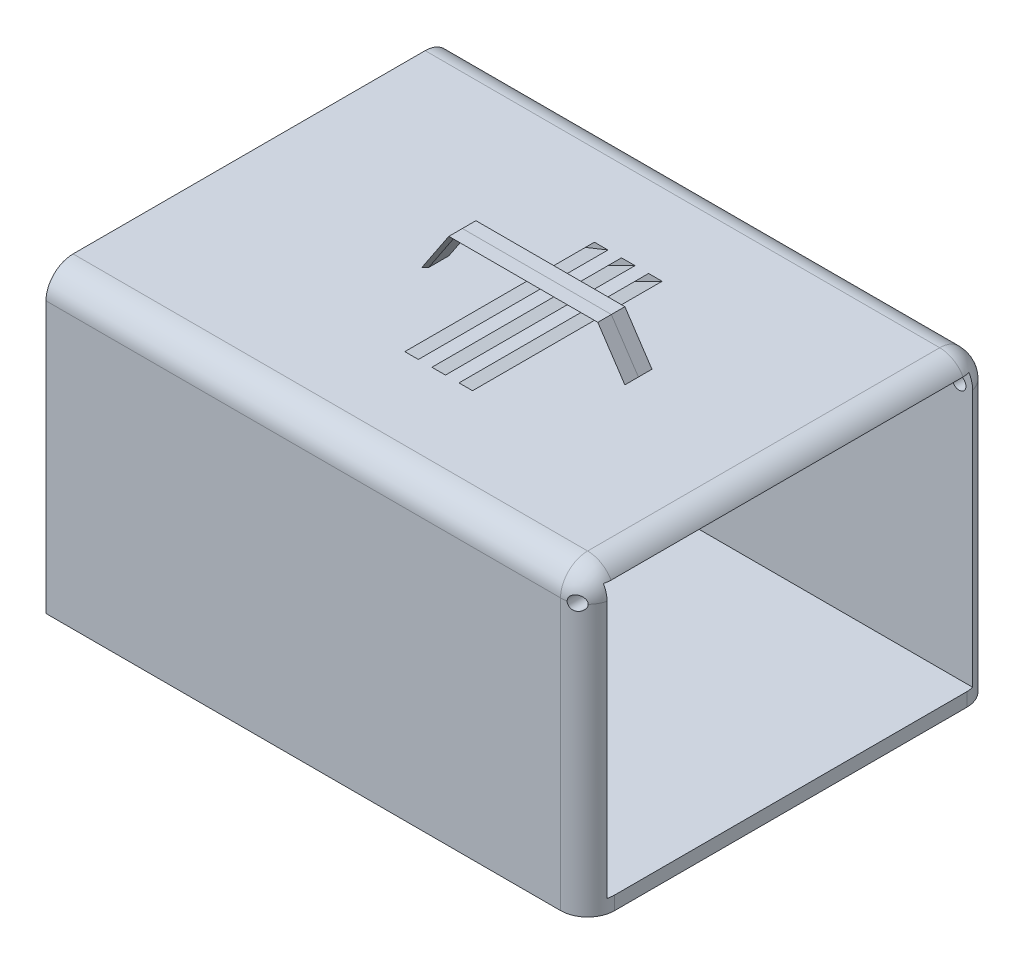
SolidWorks part; units mm, degrees
ref_plane "Front Plane" through (0, 0, 0) normal (0, 0, 1) x (1, 0, 0)
ref_plane "Top Plane" through (0, 0, 0) normal (0, 1, 0) x (1, 0, 0)
ref_plane "Right Plane" through (0, 0, 0) normal (1, 0, 0) x (0, 0, -1)
sketch "Sketch1" plane through (0, 0, 0) normal (0, 0, 1) x (1, 0, 0)
  line L0 (0, 0) -> (400, 0)
  line L1 (400, 0) -> (400, 220)
  line L2 (400, 220) -> (0, 220)
  line L3 (0, 220) -> (0, 0)
  dimension "D1" = 400
  dimension "D2" = 220
extrude "Boss-Extrude1" add sketch "Sketch1" along normal blind 300
sketch "Sketch2" plane through (400, 0, 0) normal (1, 0, 0) x (0, 0, -1)
  line L0 (-300, 0) -> (-285, 0) construction
  line L1 (-300, 0) -> (0, 0) construction
  line L2 (-285, 0) -> (-285, 10) construction
  line L3 (0, 0) -> (0, 220) construction
  line L4 (-285, 10) -> (-15, 10)
  line L5 (-285, 10) -> (-285, 210)
  line L6 (-285, 210) -> (-15, 210)
  line L7 (-15, 10) -> (-15, 210)
  line L8 (-300, 220) -> (0, 220) construction
  dimension "D1" = 15
  dimension "D2" = 10
  dimension "D3" = 15
  dimension "D4" = 10
extrude "Cut-Extrude1" cut sketch "Sketch2" against normal blind 390
fillet "Fillet1" radius 20 2 edges at (200, 220, 0) (200, 220, 300)
fillet "Fillet2" radius 20 2 edges at (400, 100, 0) (400, 100, 300)
sketch "Sketch3" plane through (0, 0, 0) normal (0, -1, 0) x (1, 0, 0)
  line L0 (0, 150) -> (33.64, 150) construction
  line L1 (0, 300) -> (0, 0) construction
  line L2 (33.64, 270) -> (33.64, 30)
  line L3 (33.64, 30) -> (83.64, 30)
  line L4 (83.64, 30) -> (83.64, 270)
  line L5 (83.64, 270) -> (33.64, 270)
  point P8 (33.64, 150)
  dimension "D1" = 33.64
  dimension "D2" = 240
  dimension "D3" = 50
extrude "Cut-Extrude2" cut sketch "Sketch3" against normal blind 20
sketch "Sketch4" plane through (0, 0, 0) normal (0, -1, 0) x (1, 0, 0)
  line L0 (360, 0) -> (360, 4) construction
  line L1 (0, 0) -> (380, 0) construction
  line L2 (400, 280) -> (400, 20) construction
  line L3 (360, 4) -> (120, 4)
  line L4 (120, 4) -> (120, 6)
  line L5 (120, 6) -> (360, 6)
  line L6 (360, 6) -> (360, 4)
  line L7 (400, 150) -> (83.64, 150) construction
  line L8 (83.64, 30) -> (83.64, 270) construction
  dimension "D1" = 40
  dimension "D2" = 4
  dimension "D3" = 2
  dimension "D4" = 240
ref_plane "Plane1" through (0, 0, 150) normal (0, 0, 1) x (-1, 0, 0)
extrude "Cut-Extrude3" cut sketch "Sketch4" against normal blind 100
mirror "Mirror1" about plane through (0, 0, 150) normal (0, 0, 1) of "Cut-Extrude3"
ref_plane "Ebene1" through (0, 0, 150) normal (0, 0, -1) x (-1, 0, 0)
ref_plane "Ebene2" through (200, 0, 0) normal (-1, 0, 0) x (0, 0, 1)
sketch "Skizze3" plane through (0, 0, 285) normal (0, 0, -1) x (-1, 0, 0)
  line L0 (-399.3649, 200) -> (-399.3649, 10) construction
  line L1 (-10, 210) -> (-396.5831, 210) construction
  circle A0 centre (-389.3649, 200) radius 5
  dimension "D3" = 10
  dimension "D1" = 10
  dimension "D2" = 10
extrude "Schnitt-Linear austragen1" cut sketch "Skizze3" against normal up to next
mirror "Spiegeln1" about plane through (0, 0, 150) normal (0, 0, -1) of "Schnitt-Linear austragen1"
sketch "Sketch6" plane through (0, 220, 0) normal (0, 1, 0) x (1, 0, 0)
  line L2 (185, -80) -> (185, -220)
  line L3 (185, -220) -> (195, -220)
  line L4 (195, -220) -> (195, -80)
  line L5 (195, -80) -> (185, -80)
  line L6 (195, -80) -> (205, -80) construction
  line L7 (215, -80) -> (225, -80) construction
  line L8 (205, -80) -> (215, -80)
  line L9 (205, -80) -> (205, -220)
  line L10 (205, -220) -> (215, -220)
  line L11 (215, -80) -> (215, -220)
  line L12 (185, -150) -> (0, -150) construction
  line L13 (225, -80) -> (235, -80)
  line L14 (225, -80) -> (225, -220)
  line L15 (225, -220) -> (235, -220)
  line L16 (235, -80) -> (235, -220)
  line L17 (0, -280) -> (0, -20) construction
  point P7 (185, -150)
  dimension "D1" = 185
  dimension "D2" = 10
  dimension "D3" = 10
  dimension "D4" = 10
  dimension "D5" = 10
  dimension "D6" = 10
  dimension "D7" = 140
  dimension "D8" = 140
  dimension "D9" = 140
sketch "Sketch7" plane through (0, 210, 0) normal (0, -1, 0) x (1, 0, 0)
  line L0 (160, 150) -> (0, 150) construction
  line L2 (160, 220) -> (160, 80)
  line L3 (160, 220) -> (170, 220)
  line L4 (170, 220) -> (170, 80)
  line L5 (170, 80) -> (160, 80)
  point P3 (0, 150)
  point P8 (160, 150)
  dimension "D1" = 140
  dimension "D2" = 10
  dimension "D3" = 160
loft "Cut-Loft2" cut
sketch "Sketch8" plane through (0, 220, 0) normal (0, 1, 0) x (1, 0, 0)
  line L0 (195, -80) -> (205, -80) construction
  line L2 (205, -80) -> (215, -80)
  line L3 (205, -80) -> (205, -220)
  line L4 (205, -220) -> (215, -220)
  line L5 (215, -80) -> (215, -220)
  dimension "D1" = 140
  dimension "D2" = 10
  dimension "D3" = 10
sketch "Sketch9" plane through (0, 210, 0) normal (0, -1, 0) x (1, 0, 0)
  line L0 (205, 220) -> (195, 220) construction
  line L2 (195, 220) -> (185, 220)
  line L3 (195, 220) -> (195, 80)
  line L4 (195, 80) -> (185, 80)
  line L5 (185, 220) -> (185, 80)
  dimension "D1" = 10
  dimension "D2" = 140
  dimension "D3" = 10
loft "Cut-Loft3" cut profiles "Sketch9", "Sketch8"
sketch "Sketch10" plane through (0, 220, 0) normal (0, 1, 0) x (1, 0, 0)
  line L0 (215, -80) -> (225, -80) construction
  line L2 (225, -80) -> (235, -80)
  line L3 (225, -80) -> (225, -220)
  line L4 (225, -220) -> (235, -220)
  line L5 (235, -80) -> (235, -220)
  dimension "D1" = 10
  dimension "D2" = 140
  dimension "D3" = 10
sketch "Sketch11" plane through (0, 210, 0) normal (0, -1, 0) x (1, 0, 0)
  line L0 (225, 220) -> (215, 220) construction
  line L2 (215, 220) -> (205, 220)
  line L3 (215, 220) -> (215, 80)
  line L4 (215, 80) -> (205, 80)
  line L5 (205, 220) -> (205, 80)
  dimension "D1" = 140
  dimension "D2" = 10
  dimension "D3" = 10
loft "Cut-Loft4" cut profiles "Sketch11", "Sketch10"
sketch "Sketch12" plane through (0, 220, 0) normal (0, 1, 0) x (1, 0, 0)
  line L0 (0, -150) -> (140, -150) construction
  line L1 (0, -280) -> (0, -20) construction
  line L2 (140, -142.5) -> (140, -157.5)
  line L3 (140, -157.5) -> (137.5, -160)
  line L5 (137.5, -140) -> (140, -142.5)
  line L6 (137.5, -155.6972) -> (140, -155.6972) construction
  line L7 (138.75, -155.6972) -> (138.75, -150) construction
  line L8 (137.5, -140) -> (137.5, -150)
  line L9 (137.5, -150) -> (137.5, -160)
  point P7 (140, -150)
  dimension "D1" = 15
  dimension "D2" = 20
  dimension "D3" = 45
  dimension "D4" = 45
  dimension "D5" = 140
  dimension "D6" = 4.3028
ref_plane "Plane2" through (0, 0, 150) normal (0, 0, 1) x (1, 0, 0)
sketch "Sketch13" plane through (0, 0, 150) normal (0, 0, 1) x (1, 0, 0)
  line L0 (137.5, 220) -> (157.5, 250)
  line L1 (157.5, 250) -> (267.5, 250)
  line L2 (267.5, 250) -> (287.5, 220)
  point P7 (157.6213, 220.0003)
  point P9 (0, 0)
  point P10 (157.7002, 219.9313)
  dimension "D1" = 20
  dimension "D2" = 110
  dimension "D3" = 20
  dimension "D4" = 30
  dimension "D5" = 30
sweep "Sweep3" add profiles "Sketch12" path "Sketch13"
